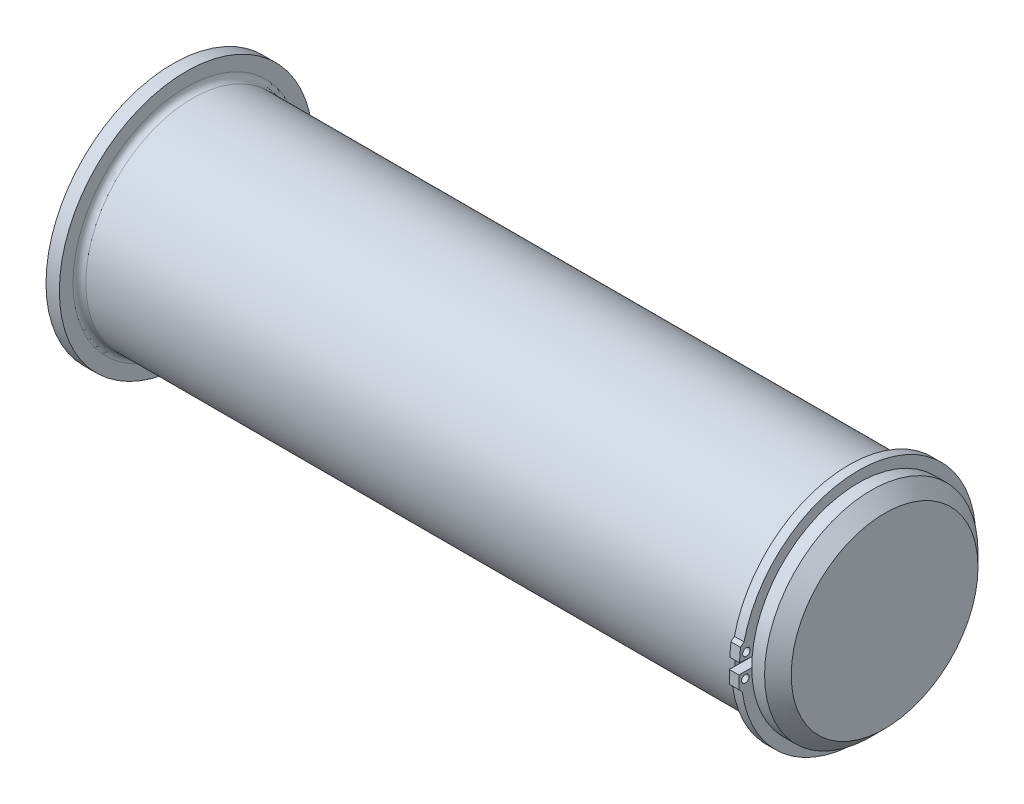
SolidWorks part; units mm, degrees
ref_plane "Front Plane" through (0, 0, 0) normal (0, 0, 1) x (1, 0, 0)
ref_plane "Top Plane" through (0, 0, 0) normal (0, 1, 0) x (1, 0, 0)
ref_plane "Right Plane" through (0, 0, 0) normal (1, 0, 0) x (0, 0, -1)
sketch "Sketch3" plane through (0, 0, 0) normal (0, 0, 1) x (1, 0, 0)
  line L0 (0, 0) -> (81.3435, 0)
  line L1 (0, 0) -> (0, 12.7) construction
  line L2 (0, 12.7) -> (76.2, 12.7)
  line L3 (76.2, 12.7) -> (76.2, 11.049)
  line L4 (76.2, 11.049) -> (78.232, 11.049)
  line L5 (78.232, 11.049) -> (78.232, 12.7)
  line L6 (78.232, 12.7) -> (79.756, 12.7)
  line L7 (79.756, 12.7) -> (81.3435, 11.1125)
  line L8 (81.3435, 11.1125) -> (81.3435, 0)
  line L9 (0, 12.7) -> (-1.016, 12.7)
  line L10 (-1.778, 13.462) -> (-1.778, 15.0876)
  line L11 (-1.778, 15.0876) -> (-3.3655, 15.0876)
  line L12 (-3.3655, 15.0876) -> (-3.3655, 0)
  line L13 (-3.3655, 0) -> (0, 0)
  arc A0 (-1.016, 12.7) -> (-1.778, 13.462) centre (-1.016, 13.462) cw
  point P13 (77.216, 11.049)
  point P17 (-1.778, 12.7)
  dimension "D7" = 0.762
  dimension "D1" = 12.7
  dimension "D2" = 76.2
  dimension "D3" = 11.049
  dimension "D4" = 15.0876
  dimension "D5" = 1.5875
  dimension "D6" = 1.778
  dimension "D8" = 2.032
  dimension "D9" = 1.524
  dimension "D10" = 1.5875
  dimension "D11" = 135
revolve "Revolve1" add sketch "Sketch3" angle 360 about L0
sketch "Sketch5" plane through (78.232, 0, 0) normal (-1, 0, 0) x (0, 0, 1)
  line L0 (11.007, 0.963) -> (14.1699, 1.2397)
  line L1 (14.1699, 1.2397) -> (14.037, 2.7579)
  line L2 (14.037, 2.7579) -> (13.6199, 3.1079)
  line L3 (11.049, 0) -> (14.224, 0)
  line L4 (14.224, 0) -> (14.224, -1.524)
  line L5 (14.224, -1.524) -> (13.8389, -1.9091)
  line L6 (11.007, 0.963) -> (0, 0) construction
  line L7 (0, 0) -> (11.049, 0) construction
  line L8 (14.1035, 1.9988) -> (13.3444, 1.9324) construction
  line L9 (14.224, -0.762) -> (13.462, -0.762) construction
  arc A0 (11.007, 0.963) -> (11.049, 0) centre (0, 0) ccw
  arc A1 (13.6199, 3.1079) -> (13.8389, -1.9091) centre (0, 0) ccw
  circle A4 centre (13.3444, 1.9324) radius 0.4445
  circle A5 centre (13.462, -0.762) radius 0.4445
  circle A6 centre (0, 0) radius 11.049 construction
  dimension "D2" = 13.97
  dimension "D8" = 0.889
  dimension "D3" = 3.175
  dimension "D4" = 1.524
  dimension "D5" = 5
  dimension "D6" = 135
  dimension "D7" = 135
  dimension "D9" = 0.762
extrude "Boss-Extrude1" add sketch "Sketch5" along normal blind 1.143
